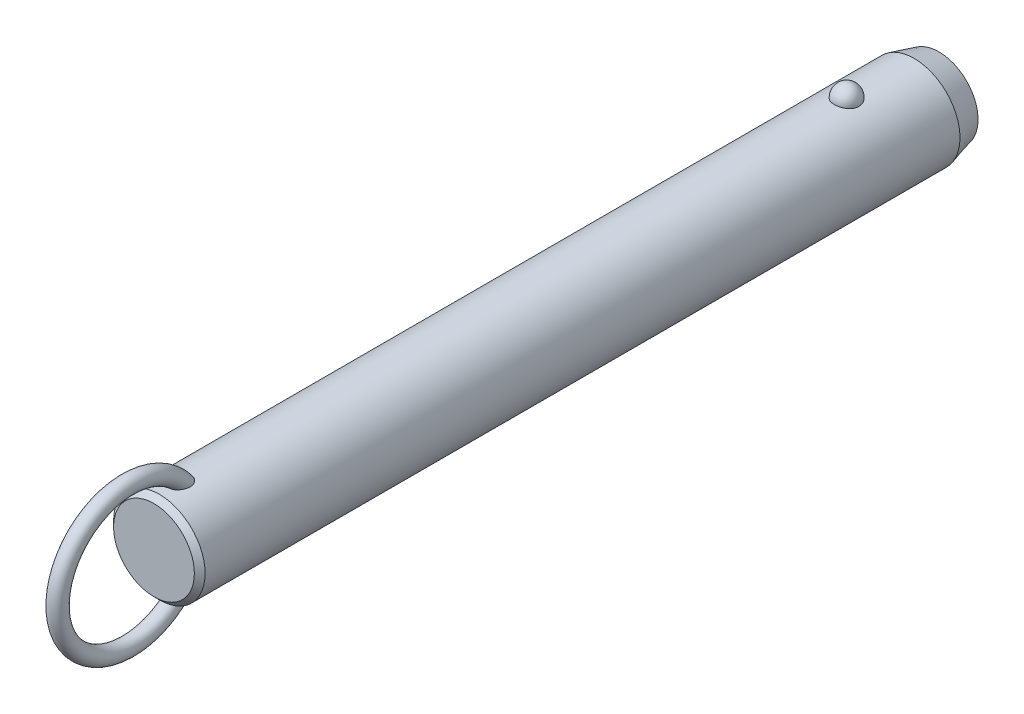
SolidWorks part; units mm, degrees
ref_plane "Front Plane" through (0, 0, 0) normal (0, 0, 1) x (1, 0, 0)
ref_plane "Top Plane" through (0, 0, 0) normal (0, 1, 0) x (1, 0, 0)
ref_plane "Right Plane" through (0, 0, 0) normal (1, 0, 0) x (0, 0, -1)
sketch "Sketch2" plane through (0, 0, 0) normal (0, 0, 1) x (1, 0, 0)
  circle A0 centre (0, 0) radius 11.1
  point P3 (0, 11.1)
  dimension "D1" = 22.2
extrude "Boss-Extrude1" add sketch "Sketch2" along normal blind 152.4
sketch "Sketch3" plane through (0, 0, 0) normal (0, 0, -1) x (-1, 0, 0)
  circle A0 centre (0, 0) radius 11.1
  dimension "D1" = 22.2
extrude "Boss-Extrude2" add sketch "Sketch3" along normal blind 25.4
chamfer "Chamfer1" distance 6 angle 15 1 edges at (-11.1, 0, -25.4)
sketch "Sketch12" plane through (0, 0, 0) normal (1, 0, 0) x (0, 0, -1)
  line L0 (-152.4, 11.1) -> (-152.4, -11.1) construction
  point P0 (-152.4, 0)
sketch "Sketch13" plane through (0, 0, 0) normal (1, 0, 0) x (0, 0, -1)
  circle A0 centre (-171.45, 0) radius 19.05
  point P2 (-152.4, 0)
  dimension "D1" = 38.1
sketch "Sketch14" plane through (0, 0, 0) normal (0, 1, 0) x (1, 0, 0)
  circle A0 centre (0, -154.4) radius 2
  point P2 (0, -152.4)
  dimension "D1" = 4
sweep "Sweep1" add profiles "Sketch14" path "Sketch13"
sketch "Sketch15" plane through (0, 0, 152.4) normal (0, 0, 1) x (1, 0, 0)
  circle A0 centre (0, 0) radius 11.1
  dimension "D1" = 22.2
extrude "Boss-Extrude3" add sketch "Sketch15" along normal blind 12.7
chamfer "Chamfer2" distance 1.3 angle 45 1 edges at (11.1, 0, 165.1)
sketch "Sketch18" plane through (0, 0, 0) normal (1, 0, 0) x (0, 0, -1)
  line L0 (19.4, 11.1) -> (-155.968, 11.1) construction
  line L1 (3, 14.1) -> (3, 8.1)
  line L2 (-155.968, -11.1) -> (19.4, -11.1) construction
  arc A0 (3, 14.1) -> (3, 8.1) centre (3, 11.1) ccw
  point P4 (0, 11.1)
  dimension "D1" = 25.2
revolve "Revolve1" add sketch "Sketch18" angle 360 about L1
